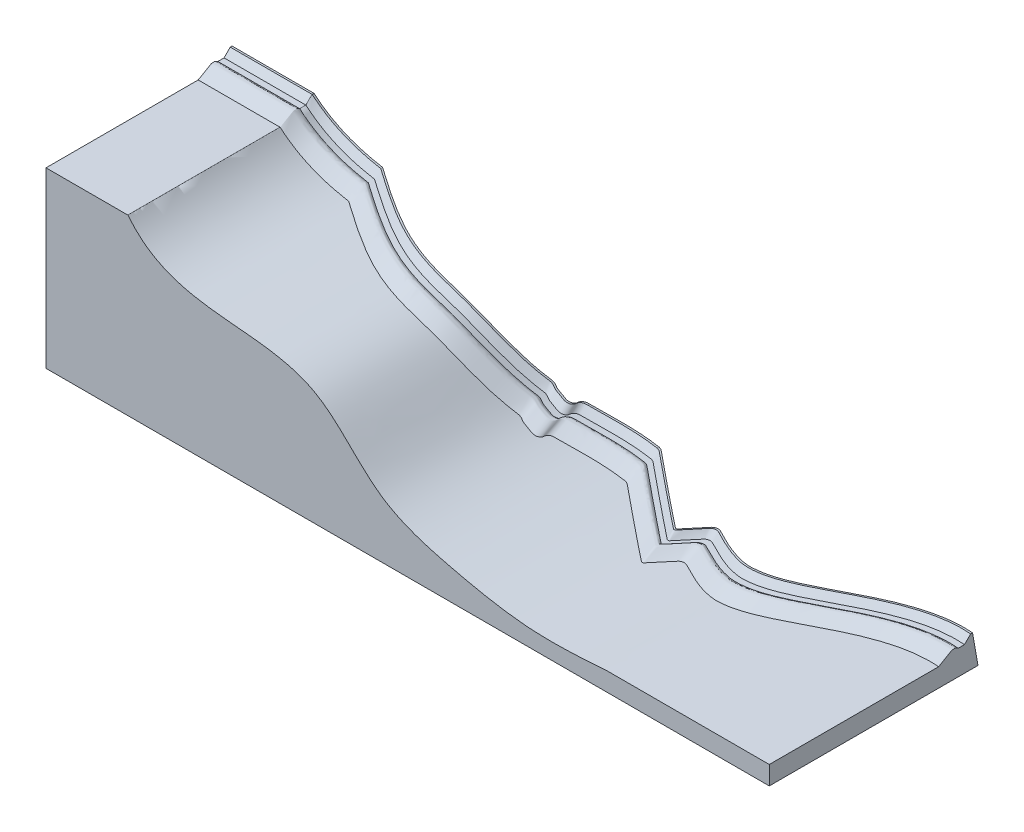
SolidWorks part; units mm, degrees
ref_plane "Ebene vorne" through (0, 0, 0) normal (0, 0, 1) x (1, 0, 0)
ref_plane "Ebene oben" through (0, 0, 0) normal (0, 1, 0) x (1, 0, 0)
ref_plane "Ebene rechts" through (0, 0, 0) normal (1, 0, 0) x (0, 0, -1)
imported_body "Imported1"
sketch "Skizze2" plane through (-109.2515, 0, 0) normal (-1, 0, 0) x (0, 0, 1)
  line L0 (-59.4, 60) -> (-60, 60)
  line L1 (-60, 60) -> (-60, 70)
  line L2 (-60, 70) -> (0, 70)
  line L3 (0, 70) -> (0, 60) construction
  line L4 (0, 56) -> (10, 56)
  line L5 (0, 70) -> (10, 70)
  line L6 (10, 70) -> (10, 56)
  line L8 (0, 56) -> (0, 60)
  line L9 (0, 60) -> (-59.4, 60)
  line L10 (-59.4, 60) -> (-57.4, 58)
  line L11 (-57.4, 58) -> (-55.4, 58)
  line L12 (-55.4, 58) -> (-54.766, 58.366)
  line L13 (-54.266, 58.5) -> (-53.6639, 58.5)
  line L14 (-53.1639, 58.366) -> (-49.0658, 56)
  line L15 (-49.0658, 56) -> (0, 56)
  line L16 (0, 56) -> (0, 60) construction
  line L17 (0, 60) -> (-59.4, 60) construction
  line L18 (-59.4, 60) -> (-57.4, 58)
  line L19 (-57.4, 58) -> (-55.4, 58)
  line L20 (-55.4, 58) -> (-54.766, 58.366)
  line L21 (-54.266, 58.5) -> (-53.6639, 58.5)
  line L22 (-53.1639, 58.366) -> (-49.0658, 56)
  line L23 (-49.0658, 56) -> (0, 56)
  arc A2 (-54.266, 58.5) -> (-54.766, 58.366) centre (-54.266, 57.5) ccw
  arc A3 (-53.1639, 58.366) -> (-53.6639, 58.5) centre (-53.6639, 57.5) ccw
  arc A4 (-54.266, 58.5) -> (-54.766, 58.366) centre (-54.266, 57.5) ccw
  arc A5 (-53.1639, 58.366) -> (-53.6639, 58.5) centre (-53.6639, 57.5) ccw
  dimension "D2" = 10
  dimension "D3" = 10
  dimension "D1" = 0
sketch "Skizze1" plane through (0, 10, 0) normal (0, 1, 0) x (1, 0, 0)
  line L0 (123.9386, 53.5483) -> (123.9386, 0) construction
  line L1 (71.135, 0) -> (123.9386, 0) construction
  line L2 (123.9386, 64.9193) -> (123.9386, 65.5214)
  line L3 (71.135, 48.2509) -> (71.135, 47.6501)
  line L4 (123.9386, 64.9193) -> (123.9386, 65.5214)
  line L5 (71.135, 48.2509) -> (71.135, 47.6501)
  line L6 (71.135, 0) -> (71.135, 47.6501) construction
  line L7 (123.9386, 57.6612) -> (123.9386, 53.5483) construction
  line L8 (123.9386, 57.6612) -> (123.9386, 58.163) construction
  line L9 (123.9386, 58.7632) -> (123.9386, 58.163) construction
  line L10 (123.9386, 58.7632) -> (123.9386, 59.265) construction
  line L11 (123.9386, 59.9013) -> (123.9386, 59.265) construction
  line L12 (123.9386, 62.9121) -> (123.9386, 59.9013) construction
  line L13 (123.9386, 64.9193) -> (123.9386, 62.9121) construction
  line L14 (123.9386, 53.5483) -> (123.9386, 0)
  line L15 (71.135, 0) -> (123.9386, 0)
  line L17 (123.9386, 57.6612) -> (123.9386, 53.5483)
  line L18 (123.9386, 57.6612) -> (123.9386, 58.163)
  line L19 (123.9386, 58.7632) -> (123.9386, 58.163)
  line L20 (123.9386, 58.7632) -> (123.9386, 59.265)
  line L21 (123.9386, 59.9013) -> (123.9386, 59.265)
  line L22 (123.9386, 62.9121) -> (123.9386, 59.9013)
  line L23 (123.9386, 64.9193) -> (123.9386, 62.9121)
  line L24 (71.135, 0) -> (71.135, 47.6501)
  spline S2 degree 3 poles (-1335.4322, -3636.9131) (391.7748, -196.859) (201.7576, 72.8956) (114.3015, 65.1888) (110.9592, 64.4009) (104.6442, 62.3469) (101.6631, 61.0794) (95.9651, 58.4023) (93.2467, 56.9903) (88.0371, 54.296) (85.5456, 53.0139) (80.8288, 50.8267) (78.605, 49.9248) (75.5485, 48.9856) (74.5767, 48.7405) (-9.9152, 32.6761) (330.0369, 591.263) (-3824.2654, -705.0038) knots 0.056801 0.056801 0.056801 0.056801 0.799406 0.799406 0.830656 0.830656 0.861906 0.861906 0.893156 0.893156 0.924406 0.924406 0.955656 0.955656 0.971281 0.971281 2.389218 2.389218 2.389218 2.389218 only from (123.9386, 65.5214) to (71.135, 48.2509)
  spline S3 degree 3 poles (400.0002, 992.0245) (171.8435, 373.8027) (3.0518, 28.7539) (76.5386, 48.6505) (77.3941, 48.9215) (79.1598, 49.5481) (80.0698, 49.9038) (82.8715, 51.082) (84.8338, 52.0178) (88.9088, 54.0619) (91.0231, 55.17) (95.3948, 57.4165) (97.6551, 58.5539) (102.3449, 60.7065) (104.7754, 61.7202) (109.8566, 63.4408) (112.511, 64.1504) (165.1256, 72.3716) (255.9848, -9.695) (98.5967, -934.723) knots -5.379756 -5.379756 -5.379756 -5.379756 0.125 0.125 0.1875 0.1875 0.25 0.25 0.375 0.375 0.5 0.5 0.625 0.625 0.75 0.75 0.875 0.875 3.120839 3.120839 3.120839 3.120839 only from (71.135, 47.6501) to (123.9386, 64.9193)
  spline S4 degree 3 poles (123.9386, 65.5214) (121.8619, 65.6948) (119.8179, 65.6749) (114.3015, 65.1888) (110.9592, 64.4009) (104.6442, 62.3469) (101.6631, 61.0794) (95.9651, 58.4023) (93.2467, 56.9903) (88.0371, 54.296) (85.5456, 53.0139) (80.8288, 50.8267) (78.605, 49.9248) (75.5485, 48.9856) (74.5767, 48.7405) (72.7699, 48.397) (71.9316, 48.2931) (71.135, 48.2509) knots 0.781844 0.781844 0.781844 0.781844 0.799406 0.799406 0.830656 0.830656 0.861906 0.861906 0.893156 0.893156 0.924406 0.924406 0.955656 0.955656 0.971281 0.971281 0.986312 0.986312 0.986312 0.986312
  dimension "D1" = 0
extrude "Aufsatz-Linear austragen1" add sketch "Skizze1" against normal up to surface (4 mm away)
sketch3d "3D-Skizze1"
  line L0 (-109.2515, 60, -60) -> (-82.8362, 60, -60) construction
  line L1 (-109.2515, 60, -60) -> (-82.8362, 60, -60) construction
  spline S0 degree 3 poles (-1724.8086, -1000.7875, -247.0455) (610.0026, 1277.6327, 154.7015) (-202.4645, 161.8963, -42.0329) (-78.0357, 55.1095, -60.8623) (-77.2594, 54.5085, -60.9683) (-75.6387, 53.3799, -61.1673) (-74.7903, 52.8505, -61.2606) (-72.1971, 51.3994, -61.5165) (-70.3924, 50.6044, -61.6567) (-1.1166, 26.0474, -65.9868) (149.5272, 177.3713, -39.3043) (-1699.9642, -1082.5382, -261.4603) knots -20.569023 -20.569023 -20.569023 -20.569023 0.25 0.25 0.375 0.375 0.5 0.5 0.75 0.75 9.792761 9.792761 9.792761 9.792761 only from (-82.8362, 60, -60) to (-62.7908, 48.33, -62.0577) construction
  spline S1 degree 3 poles (-672.2557, 1620.0494, 1006.5175) (-161.4054, 104.3023, -158.2626) (-117.1067, 54.58, -96.087) (-52.5987, 46.7722, -55.5935) (-50.0067, 46.5375, -54.0238) (-46.0108, 46.1717, -51.8759) (-44.6607, 46.0475, -51.1947) (-41.9112, 45.7679, -49.9326) (-40.5119, 45.6128, -49.3515) (-38.3644, 45.3299, -48.5834) (-37.6404, 45.2271, -48.3447) (-36.1739, 44.9982, -47.9078) (-35.4303, 44.8718, -47.7096) (-33.2078, 44.4542, -47.1934) (-31.7259, 44.1233, -46.9506) (-29.5097, 43.5081, -46.758) (-28.7722, 43.2832, -46.7223) (-27.6695, 42.91, -46.7089) (-27.3016, 42.7793, -46.7111) (-26.5733, 42.507, -46.7284) (-26.2128, 42.3656, -46.7433) (-24.4294, 41.6303, -46.8473) (-23.0633, 40.9524, -47.0234) (-21.1121, 39.7776, -47.389) (-20.4778, 39.3601, -47.5279) (-19.2355, 38.4827, -47.8332) (-18.6284, 38.0232, -47.9997) (-16.8591, 36.6124, -48.5267) (-15.7397, 35.6232, -48.9165) (-13.5622, 33.6025, -49.7504) (-12.5044, 32.5706, -50.1947) (-10.4061, 30.5095, -51.1283) (-9.3657, 29.4801, -51.6176) (-7.2642, 27.4659, -52.6401) (-6.2032, 26.4811, -53.1735) (36.5514, -10.4484, -74.9357) (120.6982, 16.2952, -127.0429) (1490.8942, 1337.3212, 126.6217) knots -2.897233 -2.897233 -2.897233 -2.897233 0.125 0.125 0.25 0.25 0.3125 0.3125 0.375 0.375 0.40625 0.40625 0.4375 0.4375 0.5 0.5 0.53125 0.53125 0.546875 0.546875 0.5625 0.5625 0.625 0.625 0.65625 0.65625 0.6875 0.6875 0.75 0.75 0.8125 0.8125 0.875 0.875 0.9375 0.9375 3.326194 3.326194 3.326194 3.326194 only from (-62.7908, 48.33, -62.0577) to (-1.7331, 22.8655, -55.4505) construction
  spline S2 degree 3 poles (-1591.8235, 1042.4032, 591.579) (31.2175, 8.6291, 44.5751) (9.3574, 15.334, -56.0347) (-12.2395, 29.9774, -55.1997) (-20.6228, 45.0697, 62.0287) (1615.4495, -1149.5559, -97.8972) knots -21.324735 -21.324735 -21.324735 -21.324735 0.5 0.5 24.016037 24.016037 24.016037 24.016037 only from (-0.3256, 21.9112, -55.4972) to (-1.7331, 22.8655, -55.4505) construction
  spline S3 degree 3 poles (-1578.8474, 1137.8018, -551.4692) (1660.1021, -1118.0098, 168.6098) (-1681.5525, 1148.5191, -5.0975) (1647.2486, -1058.216, -381.5366) knots -46.397349 -46.397349 -46.397349 -46.397349 46.557012 46.557012 46.557012 46.557012 only from (0.5808, 21.3438, -55.3074) to (-0.3256, 21.9112, -55.4972) construction
  spline S4 degree 3 poles (-1002.7758, -1703.4354, -55.3074) (1318.6069, 1676.5782, -55.3074) (-1231.3353, -1668.6477, -55.3074) (938.5047, 1783.4542, -55.3074) knots -91.071429 -91.071429 -91.071429 -91.071429 74.888943 74.888943 74.888943 74.888943 only from (3.0081, 19.9804, -55.3074) to (0.5808, 21.3438, -55.3074) construction
  spline S5 degree 3 poles (-1785.339, 774.9633, -528.7279) (-148.6449, 90.4377, -124.6916) (8.2407, 17.5058, -71.4152) (4.9217, 19.0413, -56.7342) (4.8781, 19.0614, -56.6044) (4.7673, 19.1131, -56.3593) (4.7007, 19.1443, -56.2447) (4.5465, 19.217, -56.0303) (4.4591, 19.2585, -55.9315) (4.1772, 19.3934, -55.6682) (3.9578, 19.5001, -55.5324) (3.6122, 19.672, -55.3978) (3.4924, 19.7322, -55.3637) (-31.7834, 37.6607, -48.7654) (-141.9382, 151.0868, -1004.5748) (360.844, 1325.4839, -1417.1978) knots -13.709798 -13.709798 -13.709798 -13.709798 0.125 0.125 0.25 0.25 0.375 0.375 0.5 0.5 0.75 0.75 0.875 0.875 37.365409 37.365409 37.365409 37.365409 only from (5.0004, 19.0049, -57.2698) to (3.0081, 19.9804, -55.3074) construction
  spline S6 degree 3 poles (1737.7206, -879.0443, 379.1635) (150.8109, -47.0486, 5.6922) (0.1923, 21.2085, -43.1767) (5.1812, 18.9219, -58.1189) (5.2785, 18.8774, -58.3106) (13.6583, 15.0998, -70.3805) (123.2988, -31.4758, 10.1917) (-1271.5166, 758.5332, 1285.3435) knots -17.542614 -17.542614 -17.542614 -17.542614 0.25 0.25 0.5 0.5 17.480468 17.480468 17.480468 17.480468 only from (5.0004, 19.0049, -57.2698) to (6.3523, 18.4047, -59.2678) construction
  spline S7 degree 3 poles (-91.1336, 1574.0859, -1301.8325) (-64.6803, 106.7383, 105.7645) (-51.7348, 34.3702, -44.258) (16.5711, 14.961, -62.7749) (18.1043, 14.5608, -63.1166) (78.7026, -0.4573, -72.9522) (184.8799, -0.616, 43.1568) (-1230.6009, -108.9392, 1480.6441) knots -10.590032 -10.590032 -10.590032 -10.590032 0.5 0.5 0.75 0.75 10.19713 10.19713 10.19713 10.19713 only from (6.3523, 18.4047, -59.2678) to (24.4234, 13.0402, -63.8447) construction
  spline S8 degree 3 poles (572.103, 1881.5387, 361.5736) (285.7609, 168.7382, 138.863) (154.0062, -3.9842, 36.3871) (39.2744, 10.1702, -52.8487) (-72.1864, 26.6863, -139.5404) (-169.4399, 184.7427, -215.182) (-486.3805, -1863.1194, -461.6914) knots -16.236709 -16.236709 -16.236709 -16.236709 0.25 0.25 0.5 16.549555 16.549555 16.549555 16.549555 only from (46.1429, 9.458, -47.5065) to (25.6543, 12.7586, -63.4421) construction
  spline S9 degree 3 poles (1715.5391, -361.7997, 931.2351) (-1790.2179, 417.4327, -846.6813) (1918.7817, -410.8986, 490.0407) (-1900.1316, 445.2076, -371.1473) knots -27.750418 -27.750418 -27.750418 -27.750418 28.854972 28.854972 28.854972 28.854972 only from (24.4234, 13.0402, -63.8447) to (25.6543, 12.7586, -63.4421) construction
  spline S10 degree 3 poles (-1825.6109, 118.4739, 644.1953) (45.8319, 9.8909, -124.5921) (51.4348, 9.1059, -48.0212) (41.6157, 9.7579, -46.7923) (27.9744, 11.0928, -121.7435) (2028.1706, -132.1428, 171.8468) knots -18.529697 -18.529697 -18.529697 -18.529697 0.5 0.5 19.4269 19.4269 19.4269 19.4269 only from (46.8446, 9.4112, -47.5942) to (46.1429, 9.458, -47.5065) construction
  spline S11 degree 3 poles (364.6512, -1893.2814, -456.2028) (210.9132, 1956.3895, -258.5396) (-63.1704, -1946.5223, 93.8536) (-216.2581, 1945.046, 290.6806) knots -73.518441 -73.518441 -73.518441 -73.518441 63.892032 63.892032 63.892032 63.892032 only from (51.5028, 9.2194, -53.5833) to (46.8446, 9.4112, -47.5942) construction
  spline S12 degree 3 poles (1947.9879, -509.7238, 52.9502) (356.3661, 10.5037, 369.7722) (29.1616, 9.5836, -39.433) (52.2211, 9.2065, -54.1842) (52.4372, 9.2035, -54.2751) (52.8994, 9.1983, -54.3807) (53.1342, 9.1963, -54.3925) (76.4568, 9.0628, -51.4224) (-17.8586, 15.7007, 335.6567) (-463.3271, -162.0965, 1869.4805) knots -28.356633 -28.356633 -28.356633 -28.356633 0.25 0.25 0.5 0.5 0.75 0.75 25.324741 25.324741 25.324741 25.324741 only from (51.5028, 9.2194, -53.5833) to (54.037, 9.1929, -54.1528) construction
  spline S13 degree 3 poles (-943.2037, 340.231, 1643.2848) (-35.6217, 39.0037, -168.5126) (-1.4218, 7.648, -81.2749) (59.4832, 9.2849, -51.3986) (60.8659, 9.3391, -50.7587) (62.9854, 9.4441, -49.9006) (63.6995, 9.4831, -49.6314) (65.1496, 9.5688, -49.1419) (65.8825, 9.6154, -48.9235) (67.3571, 9.7148, -48.5651) (68.1003, 9.7678, -48.4238) (183.5978, 18.3563, -34.987) (517.0793, 97.8119, -1406.6739) (351.1977, -1468.2434, 1037.0152) knots -10.623288 -10.623288 -10.623288 -10.623288 0.25 0.25 0.5 0.5 0.625 0.625 0.75 0.75 0.875 0.875 19.956322 19.956322 19.956322 19.956322 only from (54.037, 9.1929, -54.1528) to (71.135, 10, -48.2509) construction
  spline S14 degree 3 poles (-1903.3914, 10, 148.8187) (215.754, 10, -399.0624) (6.0262, 10, -35.707) (74.5767, 10, -48.7405) (75.5485, 10, -48.9856) (78.605, 10, -49.9248) (80.8288, 10, -50.8267) (85.5456, 10, -53.0139) (88.0371, 10, -54.296) (93.2467, 10, -56.9903) (95.9651, 10, -58.4023) (101.6631, 10, -61.0794) (104.6442, 10, -62.3469) (110.9592, 10, -64.4009) (114.3015, 10, -65.1888) (183.7818, 10, -71.3115) (315.2424, 10, 94.0163) (-469.5695, 10, 1834.3413) knots -5.538426 -5.538426 -5.538426 -5.538426 0.073514 0.073514 0.149931 0.149931 0.302767 0.302767 0.455603 0.455603 0.608438 0.608438 0.761274 0.761274 0.91411 0.91411 3.768084 3.768084 3.768084 3.768084 only from (71.135, 10, -48.2509) to (123.9386, 10, -65.5214) construction
  spline S15 degree 3 poles (-82.8362, 60, -60) (-81.6139, 58.4418, -60.2748) (-80.2636, 57.0215, -60.5252) (-78.0357, 55.1095, -60.8623) (-77.2594, 54.5085, -60.9683) (-75.6387, 53.3799, -61.1673) (-74.7903, 52.8505, -61.2606) (-72.1971, 51.3994, -61.5165) (-70.3924, 50.6044, -61.6567) (-66.665, 49.2831, -61.8897) (-64.7377, 48.7563, -61.9826) (-62.7908, 48.33, -62.0577) knots 0 0 0 0 0.25 0.25 0.375 0.375 0.5 0.5 0.75 0.75 1 1 1 1 construction
  spline S16 degree 3 poles (-62.7908, 48.33, -62.0577) (-60.2548, 47.7747, -60.4582) (-57.7229, 47.3924, -58.8101) (-52.5987, 46.7722, -55.5935) (-50.0067, 46.5375, -54.0238) (-46.0108, 46.1717, -51.8759) (-44.6607, 46.0475, -51.1947) (-41.9112, 45.7679, -49.9326) (-40.5119, 45.6128, -49.3515) (-38.3644, 45.3299, -48.5834) (-37.6404, 45.2271, -48.3447) (-36.1739, 44.9982, -47.9078) (-35.4303, 44.8718, -47.7096) (-33.2078, 44.4542, -47.1934) (-31.7259, 44.1233, -46.9506) (-29.5097, 43.5081, -46.758) (-28.7722, 43.2832, -46.7223) (-27.6695, 42.91, -46.7089) (-27.3016, 42.7793, -46.7111) (-26.5733, 42.507, -46.7284) (-26.2128, 42.3656, -46.7433) (-24.4294, 41.6303, -46.8473) (-23.0633, 40.9524, -47.0234) (-21.1121, 39.7776, -47.389) (-20.4778, 39.3601, -47.5279) (-19.2355, 38.4827, -47.8332) (-18.6284, 38.0232, -47.9997) (-16.8591, 36.6124, -48.5267) (-15.7397, 35.6232, -48.9165) (-13.5622, 33.6025, -49.7504) (-12.5044, 32.5706, -50.1947) (-10.4061, 30.5095, -51.1283) (-9.3657, 29.4801, -51.6176) (-7.2642, 27.4659, -52.6401) (-6.2032, 26.4811, -53.1735) (-4.023, 24.5978, -54.2833) (-2.9037, 23.6992, -54.8593) (-1.7331, 22.8655, -55.4505) knots 0 0 0 0 0.125 0.125 0.25 0.25 0.3125 0.3125 0.375 0.375 0.40625 0.40625 0.4375 0.4375 0.5 0.5 0.53125 0.53125 0.546875 0.546875 0.5625 0.5625 0.625 0.625 0.65625 0.65625 0.6875 0.6875 0.75 0.75 0.8125 0.8125 0.875 0.875 0.9375 0.9375 1 1 1 1 construction
  spline S17 degree 3 poles (-0.3256, 21.9112, -55.4972) (-0.5559, 22.0598, -55.5981) (-0.8001, 22.2211, -55.6419) (-1.2764, 22.5441, -55.6235) (-1.5133, 22.7089, -55.5615) (-1.7331, 22.8655, -55.4505) knots 0 0 0 0 0.5 0.5 1 1 1 1 construction
  spline S18 degree 3 poles (0.5808, 21.3438, -55.3074) (0.2693, 21.533, -55.3074) (-0.0384, 21.7258, -55.371) (-0.3256, 21.9112, -55.4972) knots 0 0 0 0 1 1 1 1 construction
  spline S19 degree 3 poles (3.0081, 19.9804, -55.3074) (2.1841, 20.4086, -55.3074) (1.3743, 20.8621, -55.3074) (0.5808, 21.3438, -55.3074) knots 0 0 0 0 1 1 1 1 construction
  spline S20 degree 3 poles (5.0004, 19.0049, -57.2698) (4.9978, 19.0061, -57.1317) (4.9811, 19.0138, -56.9971) (4.9217, 19.0413, -56.7342) (4.8781, 19.0614, -56.6044) (4.7673, 19.1131, -56.3593) (4.7007, 19.1443, -56.2447) (4.5465, 19.217, -56.0303) (4.4591, 19.2585, -55.9315) (4.1772, 19.3934, -55.6682) (3.9578, 19.5001, -55.5324) (3.6122, 19.672, -55.3978) (3.4924, 19.7322, -55.3637) (3.2516, 19.8546, -55.3186) (3.1303, 19.9169, -55.3074) (3.0081, 19.9804, -55.3074) knots 0 0 0 0 0.125 0.125 0.25 0.25 0.375 0.375 0.5 0.5 0.75 0.75 0.875 0.875 1 1 1 1 construction
  spline S21 degree 3 poles (5.0004, 19.0049, -57.2698) (5.0045, 19.003, -57.4911) (5.0429, 18.9852, -57.7049) (5.1812, 18.9219, -58.1189) (5.2785, 18.8774, -58.3106) (5.6433, 18.713, -58.8359) (5.9743, 18.5662, -59.106) (6.3523, 18.4047, -59.2678) knots 0 0 0 0 0.25 0.25 0.5 0.5 1 1 1 1 construction
  spline S22 degree 3 poles (6.3523, 18.4047, -59.2678) (9.1513, 17.209, -60.4657) (12.0535, 16.2447, -61.5503) (16.5711, 14.961, -62.7749) (18.1043, 14.5608, -63.1166) (21.2289, 13.7865, -63.6238) (22.8242, 13.4094, -63.7893) (24.4234, 13.0402, -63.8447) knots 0 0 0 0 0.5 0.5 0.75 0.75 1 1 1 1 construction
  spline S23 degree 3 poles (46.1429, 9.458, -47.5065) (44.4201, 9.5788, -48.8465) (42.702, 9.7473, -50.1828) (39.2744, 10.1702, -52.8487) (34.1457, 10.9301, -56.8377) (29.0471, 11.9898, -60.8033) (25.6543, 12.7586, -63.4421) knots 0 0 0 0 0.25 0.25 0.5 1 1 1 1 construction
  spline S24 degree 3 poles (24.4234, 13.0402, -63.8447) (24.8648, 12.9383, -63.86) (25.3022, 12.8384, -63.716) (25.6543, 12.7586, -63.4421) knots 0 0 0 0 1 1 1 1 construction
  spline S25 degree 3 poles (46.8446, 9.4112, -47.5942) (46.7634, 9.4163, -47.4899) (46.6413, 9.4242, -47.4213) (46.3826, 9.4413, -47.3889) (46.2472, 9.4506, -47.4254) (46.1429, 9.458, -47.5065) knots 0 0 0 0 0.5 0.5 1 1 1 1 construction
  spline S26 degree 3 poles (51.5028, 9.2194, -53.5833) (49.9495, 9.2514, -51.5863) (48.3968, 9.3133, -49.5899) (46.8446, 9.4112, -47.5942) knots 0 0 0 0 1 1 1 1 construction
  spline S27 degree 3 poles (51.5028, 9.2194, -53.5833) (51.6485, 9.2164, -53.7706) (51.8215, 9.2131, -53.9286) (52.2211, 9.2065, -54.1842) (52.4372, 9.2035, -54.2751) (52.8994, 9.1983, -54.3807) (53.1342, 9.1963, -54.3925) (53.604, 9.1937, -54.3327) (53.8267, 9.193, -54.263) (54.037, 9.1929, -54.1528) knots 0 0 0 0 0.25 0.25 0.5 0.5 0.75 0.75 1 1 1 1 construction
  spline S28 degree 3 poles (54.037, 9.1929, -54.1528) (55.39, 9.1919, -53.4437) (56.7455, 9.2113, -52.7416) (59.4832, 9.2849, -51.3986) (60.8659, 9.3391, -50.7587) (62.9854, 9.4441, -49.9006) (63.6995, 9.4831, -49.6314) (65.1496, 9.5688, -49.1419) (65.8825, 9.6154, -48.9235) (67.3571, 9.7148, -48.5651) (68.1003, 9.7678, -48.4238) (69.6037, 9.8796, -48.2489) (70.3647, 9.9385, -48.2209) (71.135, 10, -48.2509) knots 0 0 0 0 0.25 0.25 0.5 0.5 0.625 0.625 0.75 0.75 0.875 0.875 1 1 1 1 construction
  spline S29 degree 3 poles (71.135, 10, -48.2509) (71.9316, 10, -48.2931) (72.7699, 10, -48.397) (74.5767, 10, -48.7405) (75.5485, 10, -48.9856) (78.605, 10, -49.9248) (80.8288, 10, -50.8267) (85.5456, 10, -53.0139) (88.0371, 10, -54.296) (93.2467, 10, -56.9903) (95.9651, 10, -58.4023) (101.6631, 10, -61.0794) (104.6442, 10, -62.3469) (110.9592, 10, -64.4009) (114.3015, 10, -65.1888) (119.8179, 10, -65.6749) (121.8619, 10, -65.6948) (123.9386, 10, -65.5214) knots 0 0 0 0 0.073514 0.073514 0.149931 0.149931 0.302767 0.302767 0.455603 0.455603 0.608438 0.608438 0.761274 0.761274 0.91411 0.91411 1 1 1 1 construction
  spline S30 degree 3 number of poles 213 (-109.2515, 60, -60) -> (123.9386, 10, -65.5214)
sweep "Schnitt-Austragung1" cut profiles "Skizze2" path "3D-Skizze1"
